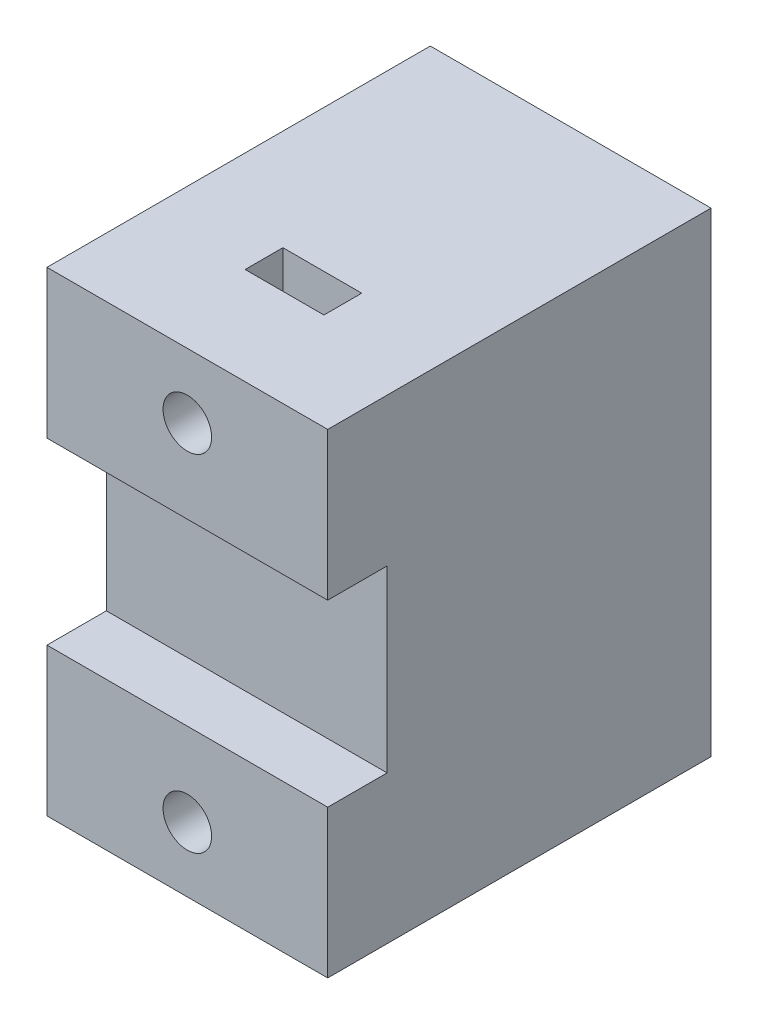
SolidWorks part; units mm, degrees
ref_plane "前视基准面" through (0, 0, 0) normal (0, 0, 1) x (1, 0, 0)
ref_plane "上视基准面" through (0, 0, 0) normal (0, 1, 0) x (1, 0, 0)
ref_plane "右视基准面" through (0, 0, 0) normal (1, 0, 0) x (0, 0, -1)
other "Configuration Table"
sketch "草图1" plane through (0, 0, 0) normal (0, 0, 1) x (1, 0, 0)
  line L0 (-13, -22) -> (13, -22)
  line L1 (13, -22) -> (13, 22)
  line L2 (13, 22) -> (-13, 22)
  line L3 (-13, 22) -> (-13, -22)
  circle A0 centre (0, -16) radius 2.25
  circle A1 centre (0, 16) radius 2.25
  dimension "D1" = 4.5
  dimension "D2" = 13
  dimension "D3" = 13
  dimension "D4" = 16
  dimension "D5" = 22
  dimension "D6" = 16
  dimension "D7" = 22
extrude "Riser_band_1" add sketch "草图1" along normal blind 23
sketch "草图2" plane through (0, 0, 0) normal (0, 0, 1) x (1, 0, 0)
  line L0 (-13, -22) -> (-3.65, -22)
  line L1 (-3.65, -22) -> (-3.65, -11.75)
  line L2 (-3.65, -11.75) -> (3.65, -11.75)
  line L3 (3.65, -11.75) -> (3.65, -22)
  line L4 (3.65, -22) -> (13, -22)
  line L5 (13, -22) -> (13, 22)
  line L6 (13, 22) -> (3.65, 22)
  line L7 (3.65, 22) -> (3.65, 11.75)
  line L8 (3.65, 11.75) -> (-3.65, 11.75)
  line L9 (-3.65, 11.75) -> (-3.65, 22)
  line L10 (-3.65, 22) -> (-13, 22)
  line L11 (-13, 22) -> (-13, -22)
  dimension "D1" = 3.65
  dimension "D2" = 13
  dimension "D3" = 3.65
  dimension "D4" = 11.75
  dimension "D5" = 22
  dimension "D6" = 11.75
extrude "Riser_band_2" add sketch "草图2" along normal blind 3.5 from offset 23
sketch "草图3" plane through (0, 0, 0) normal (0, 0, 1) x (1, 0, 0)
  line L0 (-13, -22) -> (13, -22)
  line L1 (13, -22) -> (13, 22)
  line L2 (13, 22) -> (-13, 22)
  line L3 (-13, 22) -> (-13, -22)
  circle A0 centre (0, -16) radius 2.25
  circle A1 centre (0, 16) radius 2.25
  dimension "D1" = 4.5
  dimension "D2" = 13
  dimension "D3" = 13
  dimension "D4" = 16
  dimension "D5" = 22
  dimension "D6" = 16
  dimension "D7" = 22
extrude "Riser_band_3" add sketch "草图3" along normal blind 3.5 from offset 26.5
sketch "草图4" plane through (0, 0, 0) normal (0, 0, 1) x (1, 0, 0)
  line L0 (-13, -22) -> (13, -22)
  line L1 (13, -22) -> (13, -8.3)
  line L2 (13, -8.3) -> (-13, -8.3)
  line L3 (-13, -8.3) -> (-13, -22)
  line L4 (-13, 8.3) -> (13, 8.3)
  line L5 (13, 8.3) -> (13, 22)
  line L6 (13, 22) -> (-13, 22)
  line L7 (-13, 22) -> (-13, 8.3)
  circle A0 centre (0, -16) radius 2.25
  circle A1 centre (0, 16) radius 2.25
  dimension "D1" = 4.5
  dimension "D2" = 13
  dimension "D3" = 13
  dimension "D4" = 8.3
  dimension "D5" = 16
  dimension "D6" = 22
  dimension "D7" = 8.3
  dimension "D8" = 16
extrude "Side_retention_lips_below_old_rail_top" add sketch "草图4" along normal blind 5.5 from offset 30
